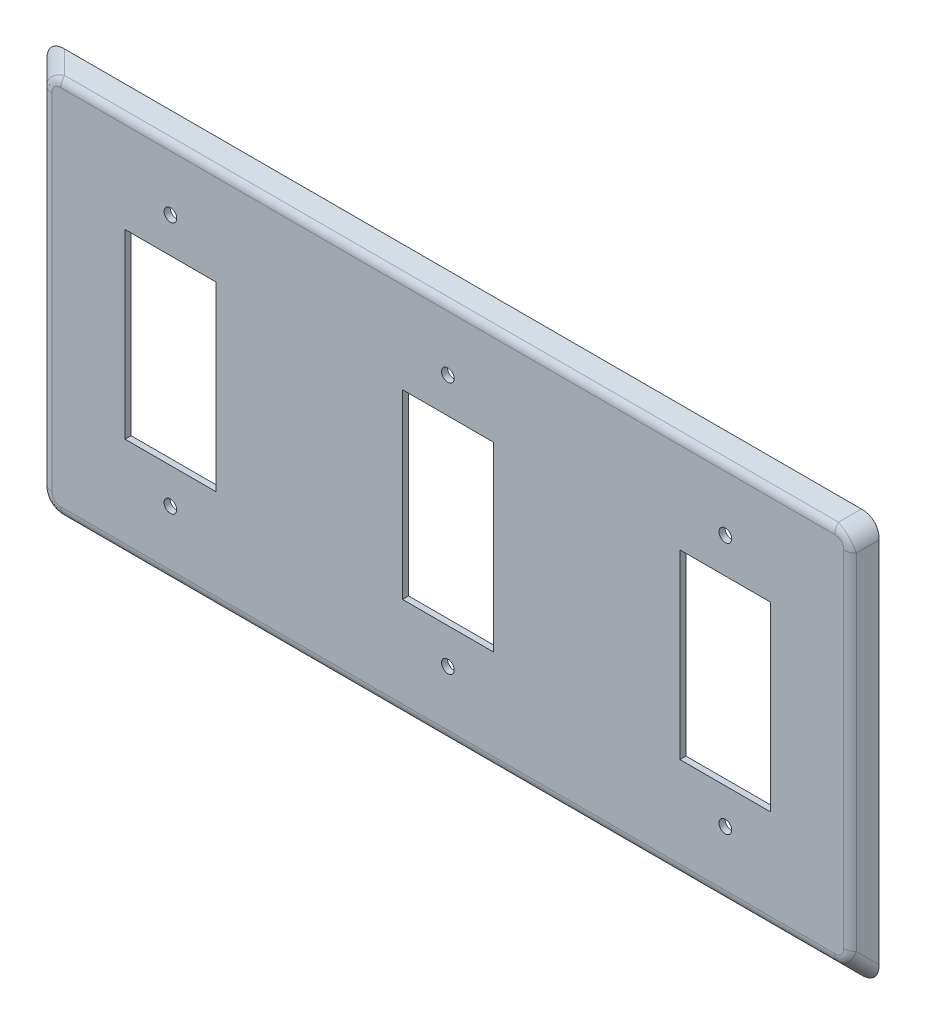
SolidWorks part; units mm, degrees
ref_plane "Front Plane" through (0, 0, 0) normal (0, 0, 1) x (1, 0, 0)
ref_plane "Top Plane" through (0, 0, 0) normal (0, 1, 0) x (1, 0, 0)
ref_plane "Right Plane" through (0, 0, 0) normal (1, 0, 0) x (0, 0, -1)
sketch "Sketch1"
  dimension "D1" = 101.6
  dimension "Width" = 209.55
extrude "Extrude1" add sketch "Sketch1" along normal blind 3.81 draft 45
fillet "Fillet1" radius 6.35 4 edges at (207.645, 1.905, 1.905) (1.905, 1.905, 1.905) (1.905, 99.695, 1.905) (207.645, 99.695, 1.905)
fillet "Fillet2" radius 3.175 8 edges at (204.5369, 96.5869, 3.81) (205.74, 50.8, 3.81) (204.5369, 5.0131, 3.81) (104.775, 3.81, 3.81) (5.0131, 5.0131, 3.81) (3.81, 50.8, 3.81) (5.0131, 96.5869, 3.81) (104.775, 97.79, 3.81)
shell "Shell1" thickness 1.524
sketch "Sketch2"
  dimension "coutout_width" = 22.86
  dimension "D2" = 45.72
  dimension "D3" = 34.925
extrude "cutout" cut sketch "Sketch2" against normal through all
sketch "Sketch3"
  dimension "D2" = 3.175
  dimension "D1" = 31.75
  dimension "D3" = 34.925
extrude "mount holes" cut sketch "Sketch3" against normal through all
pattern_linear "pattern" count 3 spacing 69.85 along (1, 0, 0) of "cutout", "mount holes"
equation "\"D2@Sketch2\" = 2 * \"coutout_width@Sketch2\""
